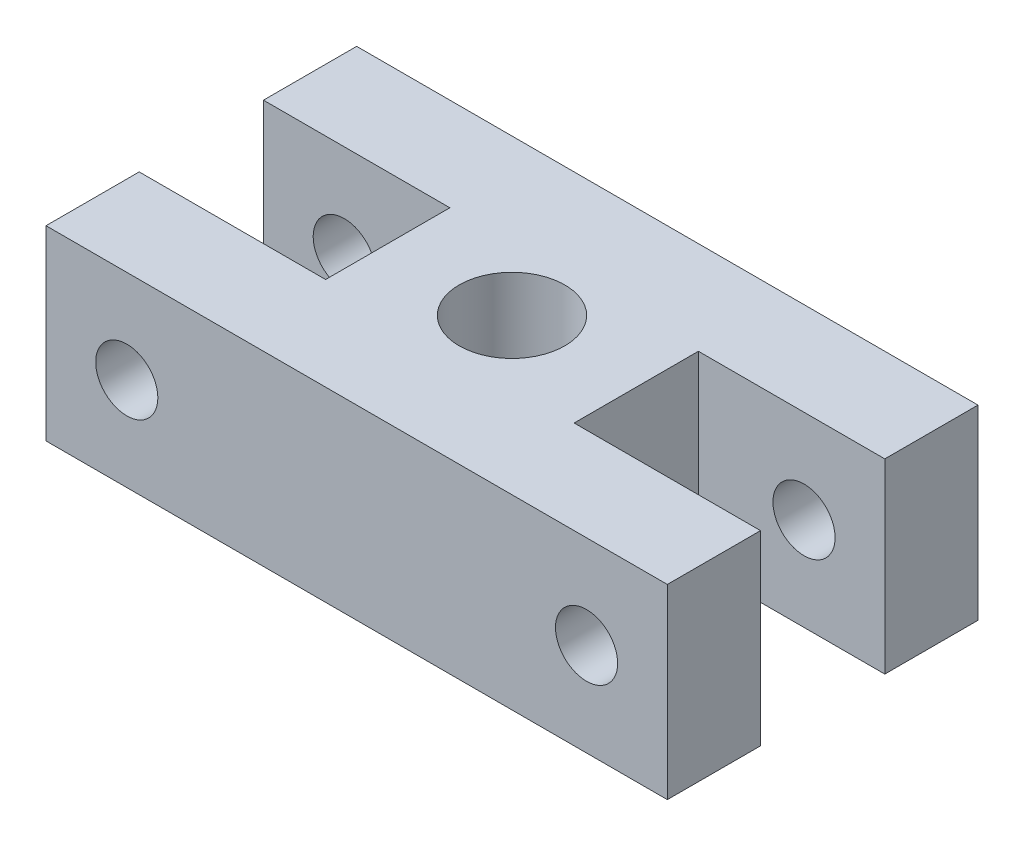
SolidWorks part; units mm, degrees
ref_plane "Vorne" through (0, 0, 0) normal (0, 0, 1) x (1, 0, 0)
ref_plane "Oben" through (0, 0, 0) normal (0, 1, 0) x (1, 0, 0)
ref_plane "Rechts" through (0, 0, 0) normal (1, 0, 0) x (0, 0, -1)
sketch "Skizze1" plane through (0, 0, 0) normal (0, 0, 1) x (1, 0, 0)
  line L0 (25, 7.5) -> (-25, -7.5) construction
  line L1 (-25, -7.5) -> (25, -7.5)
  line L2 (-25, -7.5) -> (-25, 7.5)
  line L3 (-25, 7.5) -> (25, 7.5)
  line L4 (25, -7.5) -> (25, 7.5)
  dimension "D1" = 50
  dimension "D2" = 15
extrude "Linear austragen1" add sketch "Skizze1" along normal mid plane 25
sketch "Skizze2" plane through (0, 0, 12.5) normal (0, 0, 1) x (1, 0, 0)
  line L0 (0, 8.6873) -> (0, -9.1163) construction
  circle A0 centre (-18.5, 0) radius 2.5
  circle A1 centre (18.5, 0) radius 2.5
  dimension "D1" = 5
  dimension "D2" = 37
extrude "Schnitt-Linear austragen1" cut sketch "Skizze2" against normal through all
sketch "Skizze3" plane through (0, 7.5, 0) normal (0, 1, 0) x (-1, 0, 0)
  line L0 (25, 12.5) -> (25, -12.5) construction
  line L1 (25, -5) -> (10, -5)
  line L2 (25, -5) -> (25, 5)
  line L3 (25, 5) -> (10, 5)
  line L4 (10, -5) -> (10, 5)
  line L5 (0, -9.438) -> (0, 10.4033) construction
  line L6 (-10.4033, 0) -> (7.1858, 0) construction
  line L7 (-10, -5) -> (-10, 5)
  line L8 (-25, 5) -> (-10, 5)
  line L9 (-25, -5) -> (-25, 5)
  line L10 (-25, -5) -> (-10, -5)
  dimension "D1" = 10
  dimension "D2" = 15
extrude "Schnitt-Linear austragen2" cut sketch "Skizze3" against normal through all
hole_wizard "M10 Gewindekernloch1" positions "Skizze5" profile "Skizze4" tap size "M10" standard "DIN"
sketch "Skizze5" plane through (0, 7.5, 0) normal (0, 1, 0) x (-1, 0, 0)
  point P0 (0, 0)
sketch "Skizze4" plane through (0, 7.5, 0) normal (1, 0, 0) x (0, 0, 1)
  line L0 (0, 0) -> (0, 15)
  line L1 (0, 15) -> (4.25, 15)
  line L2 (4.25, 15) -> (4.25, 0)
  line L5 (4.25, 0) -> (0, 0)
  line L11 (0, -6.35) -> (0, 107.95) construction
  dimension "Bohrerdurchmesser" = 8.5
  dimension "Bohrungstiefe" = 15
chamfer "Fase1" [suppressed] distance 0.5 angle 45
chamfer "Fase2" [suppressed] distance 1 angle 45
